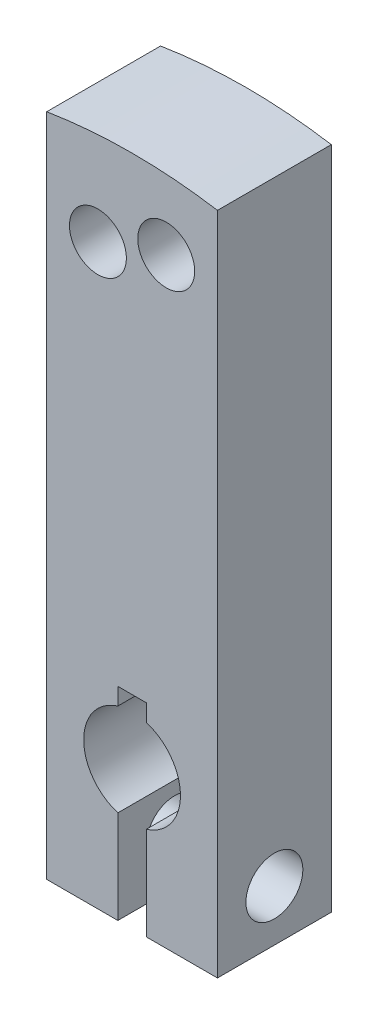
SolidWorks part; units mm, degrees
ref_plane "Face" through (0, 0, 0) normal (0, 0, 1) x (1, 0, 0)
ref_plane "Dessus" through (0, 0, 0) normal (0, 1, 0) x (1, 0, 0)
ref_plane "Droite" through (0, 0, 0) normal (1, 0, 0) x (0, 0, -1)
sketch "Esquisse1" plane through (0, 0, 0) normal (0, 0, 1) x (1, 0, 0)
  line L0 (-15, 92.2889) -> (-15, -24.5)
  line L1 (-15, -24.5) -> (-2.5, -24.5)
  line L2 (0, -111) -> (0, 135) construction
  line L3 (-2.5, -8.124) -> (-2.5, -24.5)
  line L4 (-2.5, 11.124) -> (2.5, 11.124)
  line L5 (-2.5, 11.124) -> (-2.5, 8.124)
  line L6 (15, -24.5) -> (2.5, -24.5)
  line L7 (2.5, -8.124) -> (2.5, -24.5)
  line L8 (2.5, 11.124) -> (2.5, 8.124)
  line L9 (15, 92.2889) -> (15, -24.5)
  arc A0 (-2.5, 8.124) -> (-2.5, -8.124) centre (0, 0) ccw
  arc A1 (15, 92.2889) -> (-15, 92.2889) centre (0, 0) ccw
  arc A2 (2.5, 8.124) -> (2.5, -8.124) centre (0, 0) cw
  point P17 (0, 11.124)
  dimension "D1" = 17
  dimension "D2" = 187
  dimension "D3" = 15
  dimension "D4" = 24.5
  dimension "D5" = 2.5
  dimension "D6" = 3
  dimension "D7" = 5
extrude "Base-Extrusion" add sketch "Esquisse1" against normal blind 20
sketch "Esquisse2" plane through (0, 0, 0) normal (1, 0, 0) x (0, 0, -1)
  line L0 (20, -24.5) -> (0, -24.5) construction
  line L1 (20, -24.5) -> (20, 92.2889) construction
  circle A0 centre (10, -15.5) radius 5
  dimension "D1" = 10
  dimension "D2" = 9
  dimension "D3" = 10
extrude "Enlèv. mat.-Extru.1" cut sketch "Esquisse2" against normal blind 20 and the other way blind 20
sketch "Esquisse3" plane through (0, 0, 0) normal (0, 0, 1) x (1, 0, 0)
  line L0 (0, -38) -> (0, 107) construction
  circle A0 centre (6, 81) radius 5
  circle A1 centre (-6, 77) radius 5
  dimension "D2" = 10
  dimension "D4" = 10
  dimension "D1" = 6
  dimension "D3" = 6
  dimension "D5" = 77
  dimension "D6" = 81
extrude "Enlèv. mat.-Extru.2" cut sketch "Esquisse3" against normal through all
